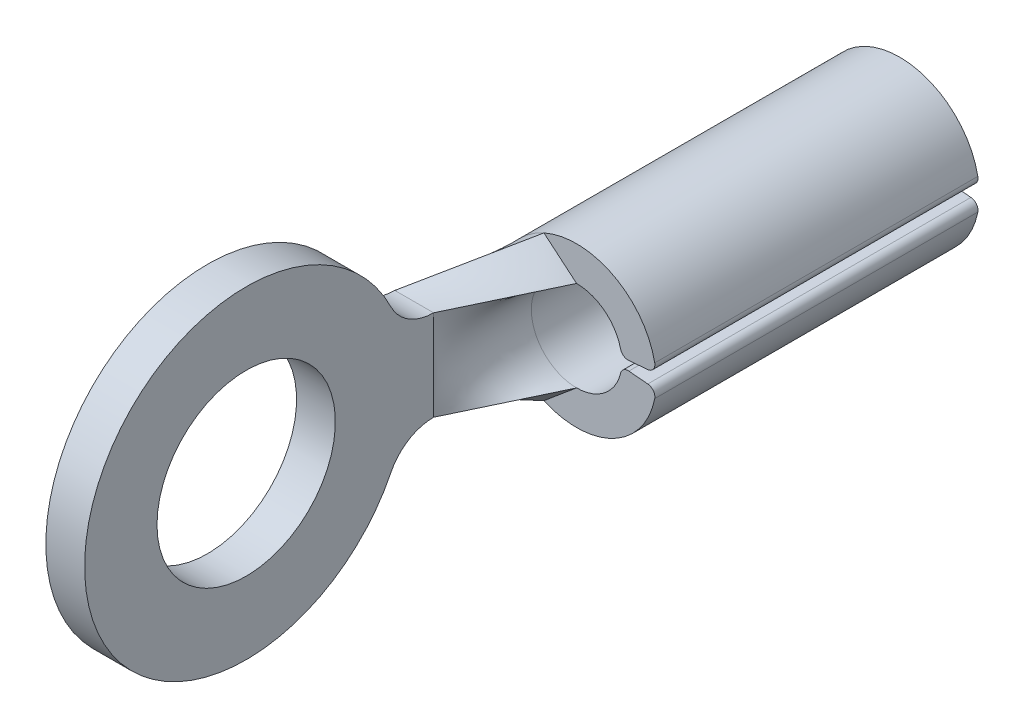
SolidWorks part; units mm, degrees
ref_plane "Front Plane" through (0, 0, 0) normal (0, 0, 1) x (1, 0, 0)
ref_plane "Top Plane" through (0, 0, 0) normal (0, 1, 0) x (1, 0, 0)
ref_plane "Right Plane" through (0, 0, 0) normal (1, 0, 0) x (0, 0, -1)
sketch "Sketch1" plane through (0, 0, 0) normal (1, 0, 0) x (0, 0, -1)
  line L0 (-10.033, 0) -> (10.033, 0) construction
  line L1 (10.033, -1.8415) -> (10.033, 1.8415) construction
  line L2 (-10.033, -3.175) -> (-10.033, 3.175) construction
  line L3 (-6.858, -1.7526) -> (-6.858, 1.7526) construction
  line L4 (-1.27, -0.889) -> (-1.27, 0.889) construction
  point P0 (-6.858, 0)
  point P4 (0, 0)
  point P8 (10.033, 0)
  point P9 (-1.27, 0)
  point P12 (-6.858, 0)
  point P13 (-10.033, 0)
  point P14 (5.08, 0)
  point P18 (-6.858, 0)
  point P20 (-1.27, 0)
  point P21 (0, 0)
  point P26 (10.033, 0)
sketch "Sketch2" plane through (0, 0, 0) normal (1, 0, 0) x (0, 0, -1)
  line L0 (10.033, -3.175) -> (10.033, 3.175) construction
  line L1 (4.1554, 2.3495) -> (10.033, 2.3495)
  line L5 (4.1554, 2.3495) -> (4.1554, 2.0193)
  line L7 (-1.27, 2.0193) -> (-1.27, 0)
  line L8 (-1.27, 0) -> (10.033, 0)
  line L11 (10.033, 2.3495) -> (10.033, 0)
  line L12 (4.1554, 2.0193) -> (-1.27, 2.0193)
  point P4 (10.033, 0)
revolve "Revolve1" [suppressed] add sketch "Sketch2" angle 360 about L8
sketch "Sketch9" plane through (0, 0, 0) normal (1, 0, 0) x (0, 0, -1)
  line L0 (10.033, 0) -> (10.033, 2.8194)
  line L1 (10.033, -1.8415) -> (10.033, 1.8415) construction
  line L2 (10.033, 2.8194) -> (9.3345, 2.8194)
  line L3 (9.3345, 2.8194) -> (9.3345, 0)
  line L4 (-10.033, 0) -> (10.033, 0) construction
  line L5 (9.3345, 0) -> (10.033, 0)
  line L6 (-1.27, 0) -> (9.3345, 0) construction
revolve "Revolve3" [suppressed] add sketch "Sketch9" angle 360 about L6
chamfer "Chamfer1" [suppressed] distance 0.254 angle 45
sketch "Sketch3" plane through (0, 0, 0) normal (1, 0, 0) x (0, 0, -1)
  line L0 (10.033, 1.8415) -> (9.8844, 1.8415)
  line L2 (10.033, 2.3495) -> (4.1554, 2.3495) construction
  line L3 (9.8844, 1.8415) -> (5.334, 1.27)
  line L4 (-1.27, 0) -> (-1.27, 0.889)
  line L5 (-1.27, 0.889) -> (4.6177, 0.889)
  line L6 (5.08, 0) -> (4.1554, 0) construction
  line L7 (-10.033, 0) -> (10.033, 0) construction
  line L8 (5.334, 1.27) -> (5.08, 1.27)
  line L9 (5.08, 1.27) -> (4.6177, 0.889)
  line L10 (-1.27, 0) -> (10.033, 0)
  line L11 (10.033, 0) -> (10.033, 1.8415)
  line L13 (4.1554, 2.3495) -> (10.033, 2.3495) construction
  point P5 (7.6092, 1.5558)
  point P18 (4.6177, 0)
revolve "Cut-Revolve1" [suppressed] cut sketch "Sketch3" angle 360 about L10
sketch "Sketch4" plane through (0, 0, 0) normal (1, 0, 0) x (0, 0, -1)
  line L0 (5.08, 0) -> (5.08, 1.5653)
  line L1 (-1.27, -1.5653) -> (5.08, -1.5653) construction
  line L2 (-1.27, -1.5653) -> (-1.27, 0) construction
  line L3 (5.08, 1.5653) -> (-1.27, 1.5653)
  line L4 (-1.27, 2.0193) -> (-1.27, 0) construction
  line L5 (-1.27, 1.5653) -> (-1.27, 0)
  line L6 (-1.27, 0) -> (5.08, 0)
  line L7 (5.08, 0) -> (5.08, -1.5653) construction
revolve "Cut-Revolve2" [suppressed] cut sketch "Sketch4" angle 360 about L6
sketch "Sketch5" plane through (0, 0, 0) normal (1, 0, 0) x (0, 0, -1)
  line L0 (5.08, 0.889) -> (5.08, 1.5653)
  line L7 (5.08, -1.5653) -> (5.08, 1.5653) construction
  line L9 (5.08, 1.5653) -> (-1.27, 1.5653)
  line L10 (-1.27, 1.5653) -> (-1.27, 0.889)
  line L11 (-1.27, 0.889) -> (5.08, 0.889)
  point P5 (5.08, 0)
revolve "Revolve2" add sketch "Sketch5" angle 360 about L0
ref_plane "Plane1" through (-1.6669, 0, 0) normal (1, 0, 0) x (0, 0, -1)
sketch "Sketch6" plane through (-1.6669, 0, 0) normal (1, 0, 0) x (0, 0, -1)
  line L1 (-10.033, 3.175) -> (10.033, 3.175) construction
  line L8 (-10.033, 0) -> (10.033, 0) construction
  line L9 (-10.033, 0) -> (10.033, 0) construction
  line L16 (-5.5115, 2.8753) -> (-1.27, 0.889) construction
  line L17 (-1.27, 2.0193) -> (-1.27, 0) construction
  line L21 (-1.27, 1.5653) -> (-1.27, -1.5653) construction
  line L22 (-5.5115, -2.8753) -> (-1.27, -0.889) construction
  line L33 (-1.27, 0.889) -> (-1.27, -0.889) construction
  line L35 (-5.5115, 2.8753) -> (-3.683, 2.019) construction
  line L36 (-5.5115, -2.8753) -> (-3.683, -2.019) construction
  line L37 (-3.175, 0.889) -> (-3.175, -0.889)
  circle A14 centre (-6.858, 0) radius 1.7526
  arc A15 (-5.5115, 2.8753) -> (-5.5115, -2.8753) centre (-6.858, 0) ccw
  arc A22 (-3.683, 2.019) -> (-3.175, 0.889) centre (-3.175, 1.5682) ccw construction
  arc A23 (-3.683, -2.019) -> (-3.175, -0.889) centre (-3.175, -1.5682) cw construction
  arc A24 (-5.5115, 2.8753) -> (-4.0128, 1.409) centre (-6.858, 0) cw
  arc A25 (-5.5115, -2.8753) -> (-4.0128, -1.409) centre (-6.858, 0) ccw
  arc A26 (-4.0128, 1.409) -> (-3.175, 0.889) centre (-3.175, 1.8239) ccw
  arc A27 (-4.0128, -1.409) -> (-3.175, -0.889) centre (-3.175, -1.8239) cw
  point P17 (-3.175, 0)
  point P21 (-3.175, 0)
extrude "Boss-Extrude1" add sketch "Sketch6" along normal blind 0.762 separate body
sketch "Sketch7" plane through (0, 0, 1.27) normal (0, 0, 1) x (1, 0, 0)
  line L0 (-0.6419, 1.4276) -> (0, 0.889)
  line L1 (-0.6419, -1.4276) -> (0, -0.889)
  line L2 (0, -1.8415) -> (0, 1.8415) construction
  circle A1 centre (0, 0) radius 0.889 construction
  circle A3 centre (0, 0) radius 0.889 construction
  circle A4 centre (0, 0) radius 1.5653 construction
  dimension "D1" = 80
loft "Loft1" add
sketch "Sketch8" plane through (0, 0, 1.27) normal (0, 0, 1) x (1, 0, 0)
  line L0 (0, 0) -> (1.5907, 0) construction
  line L1 (0, 0) -> (1.5907, 0.1392)
  line L2 (0, 0) -> (1.5907, -0.1392)
  line L3 (1.5907, 0.1392) -> (1.5907, -0.1392)
  point P6 (1.5907, 0)
extrude "Cut-Extrude1" cut sketch "Sketch8" against normal through all
fillet "Fillet2" radius 0.1524 4 edges at (0.8856, 0.0775, -1.905) (0.8856, -0.0775, -1.905) (1.5593, -0.1364, -1.905) (1.5593, 0.1364, -1.905)
equation "\"D1@Plane1\"=\"D1@Sketch4\"+.004"
equation "\"D2@Sketch5\"=\"Maximum Insulation Diameter@Sketch1\"*.85"
equation "\"D1@Sketch8\"  = \"D2@Sketch5\"/2+.001"
equation "\"D4@Sketch3\"=\"Maximum Insulation Diameter@Sketch1\"/2"
equation "\"D1@Sketch4\"=\"Maximum Insulation Diameter@Sketch1\"*.85/2"
equation "\"D1@Sketch1\" = \"Ring Width@Sketch1\" * 0.5"
equation "\"D2@Sketch6\" = \"Ring Width@Sketch1\" * 0.5"
equation "\"D2@Sketch9\"=\"D3@Sketch2\"*1.2"
equation "\"D4@Sketch2\"=\"D2@Sketch1\"*0.52"
